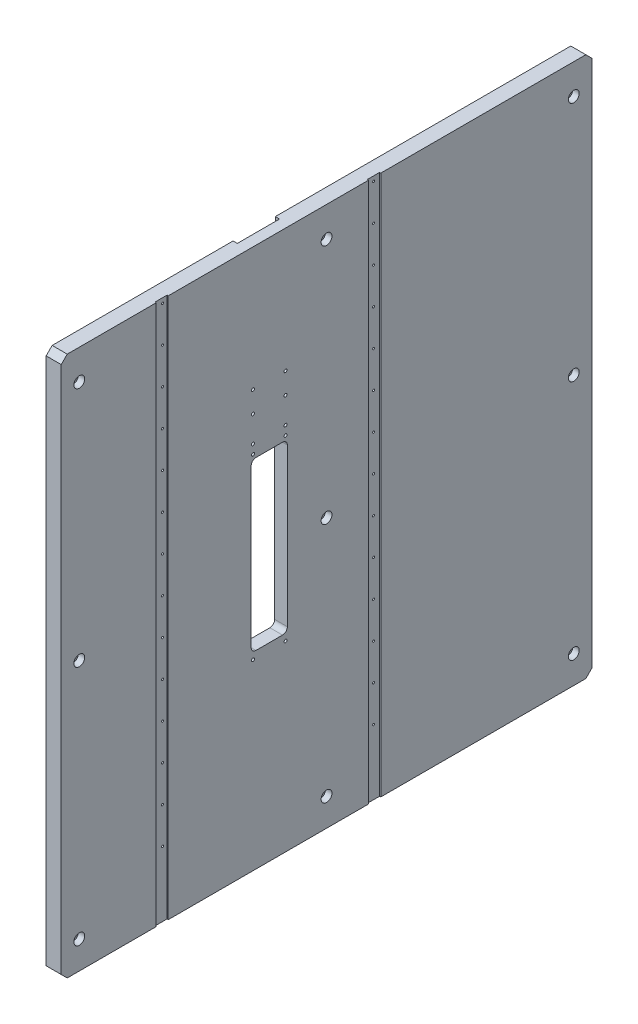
SolidWorks part; units mm, degrees
ref_plane "Plan1" through (0, 0, 0) normal (0, 0, 1) x (1, 0, 0)
ref_plane "Plan2" through (0, 0, 0) normal (0, 1, 0) x (1, 0, 0)
ref_plane "Plan3" through (0, 0, 0) normal (1, 0, 0) x (0, 0, -1)
sketch "Esquisse1" plane through (0, 0, 0) normal (1, 0, 0) x (0, 0, -1)
  line L0 (0, 1140.1905) -> (0, -182.5487) construction
  line L1 (0, 13.75) -> (0, -13.75) construction
  line L2 (13.75, 0) -> (-13.75, 0) construction
  line L3 (-440, 896) -> (440, 896)
  line L4 (-440, 896) -> (-440, 0)
  line L5 (-440, 0) -> (440, 0)
  line L6 (440, 896) -> (440, 0)
  line L9 (-117, 591) -> (-73, 591)
  line L10 (-65, 583) -> (-65, 322)
  line L11 (-73, 314) -> (-117, 314)
  line L13 (-95, 1011.7052) -> (-95, 113.1984) construction
  line L14 (-125, 583) -> (-125, 322)
  arc A0 (-73, 314) -> (-65, 322) centre (-73, 322) ccw
  arc A1 (-65, 583) -> (-73, 591) centre (-73, 583) ccw
  arc A2 (-117, 314) -> (-125, 322) centre (-117, 322) cw
  arc A3 (-125, 583) -> (-117, 591) centre (-117, 583) cw
  dimension "D8" = 8
  dimension "D1" = 896
  dimension "D2" = 440
  dimension "D3" = 305
  dimension "D4" = 30
  dimension "D5" = 440
  dimension "D6" = 277
  dimension "D7" = 95
extrude "Boss.-Extru.1" add sketch "Esquisse1" against normal blind 25
sketch "Esquisse17" plane through (0, 0, 0) normal (-1, 0, 0) x (0, 0, 1)
  line L0 (-440, 896) -> (440, 896) construction
  line L1 (-90, 896) -> (-70, 896)
  line L2 (-90, 896) -> (-90, 0)
  line L3 (-90, 0) -> (-70, 0)
  line L4 (-70, 896) -> (-70, 0)
  line L5 (262.5, 896) -> (282.5, 896)
  line L6 (262.5, 896) -> (262.5, 0)
  line L7 (262.5, 0) -> (282.5, 0)
  line L8 (282.5, 896) -> (282.5, 0)
  line L9 (440, 0) -> (-440, 0) construction
  line L10 (-80, -146.0818) -> (-80, 876.5476) construction
  line L12 (0, -13.75) -> (0, 13.75) construction
  line L14 (270, -75.7623) -> (270, 876.5476) construction
  dimension "D1" = 7.5
  dimension "D2" = 350
  dimension "D3" = 20
  dimension "D4" = 20
  dimension "D5" = 270
extrude "Enlèv. mat.-Extru.6" cut sketch "Esquisse17" along normal blind 2
hole_wizard "Trou taraudé M44" positions "Esquisse18" profile "Esquisse19" tap size "M4" standard "ISO"
sketch "Esquisse18" plane through (-2, 0, 0) normal (1, 0, 0) x (0, 0, -1)
  line L0 (-270, -75.7623) -> (-270, 876.5476) construction
  line L1 (80, -146.0818) -> (80, 876.5476) construction
  line L2 (70, 896) -> (90, 896) construction
  point P0 (80, 888)
  point P2 (-270, 888)
  dimension "D1" = 8
sketch "Esquisse19" plane through (-2, 888, -80) normal (0, 1, 0) x (0, 0, -1)
  line L0 (0, 0) -> (0, 23)
  line L1 (0, 23) -> (1.65, 23)
  line L2 (1.65, 23) -> (1.65, 0)
  line L5 (1.65, 0) -> (0, 0)
  line L11 (0, -6.35) -> (0, 107.95) construction
  dimension "Diamètre du trou pour taraudage jusqu'au prochain" = 3.3
  dimension "Profondeur du trou pour taraudage jusqu'au prochain" = 23
pattern_linear "Répétition linéaire5" count 14 spacing 60 along (0, -1, 0) of "Trou taraudé M44"
hole_wizard "Chambrage pour vis à tête hexagonale M101" positions "Esquisse22" profile "Esquisse23" counterbore size "M10" standard "ISO"
sketch "Esquisse22" plane through (0, 0, 0) normal (1, 0, 0) x (0, 0, -1)
  line L0 (0, 811.1286) -> (0, 326.5264) construction
  line L2 (0, 13.75) -> (0, -13.75) construction
  line L3 (440, 896) -> (90, 896) construction
  line L4 (-440, 0) -> (440, 0) construction
  line L5 (410, 846) -> (410, 446)
  line L6 (410, 446) -> (410, 46)
  point P0 (-410, 846)
  point P2 (410, 846)
  point P4 (410, 46)
  point P6 (-410, 46)
  point P31 (410, 446)
  point P33 (-410, 446)
  point P34 (0, 846)
  point P36 (0, 446)
  point P38 (0, 46)
  dimension "D1" = 820
  dimension "D2" = 50
  dimension "D3" = 800
  dimension "D4" = 46
sketch "Esquisse23" plane through (0, 846, 410) normal (0, 1, 0) x (0, 0, -1)
  line L0 (0, 0) -> (0, 25)
  line L1 (0, 25) -> (5.5, 25)
  line L3 (5.5, 25) -> (5.5, 10.6)
  line L4 (5.5, 10.6) -> (9, 10.6)
  line L5 (9, 10.6) -> (9, 0)
  line L7 (9, 0) -> (0, 0)
  line L11 (0, -6.35) -> (0, 107.95) construction
  dimension "Diamètre du perçage jusqu'au prochain" = 11
  dimension "Profondeur du perçage jusqu'au prochain" = 25
  dimension "Diamètre du chambrage" = 18
  dimension "Profondeur du chambrage" = 10.6
sketch "Esquisse24" plane through (-25, 0, 0) normal (-1, 0, 0) x (0, 0, 1)
  line L0 (95, 949.9984) -> (95, 121.356) construction
  line L1 (73, 314) -> (117, 314) construction
  line L2 (-440, 896) -> (440, 896) construction
  line L3 (60, 896) -> (130, 896)
  line L4 (60, 896) -> (60, 287)
  line L5 (70, 277) -> (120, 277)
  line L6 (130, 896) -> (130, 287)
  line L7 (95, 1011.7052) -> (95, 113.1984) construction
  arc A1 (70, 277) -> (60, 287) centre (70, 287) cw
  arc A2 (130, 287) -> (120, 277) centre (120, 287) cw
  dimension "D1" = 10
  dimension "D2" = 35
  dimension "D3" = 37
extrude "Enlèv. mat.-Extru.7" cut sketch "Esquisse24" against normal blind 4
hole_wizard "Trou taraudé M61" positions "Esquisse25" profile "Esquisse26" tap size "M6" standard "ISO"
sketch "Esquisse25" plane through (-21, 0, 0) normal (-1, 0, 0) x (0, 0, 1)
  line L0 (95, 949.9984) -> (95, 121.356) construction
  line L1 (95, 949.9984) -> (95, 121.356) construction
  line L5 (73, 591) -> (117, 591) construction
  point P0 (68, 691)
  point P2 (68, 656)
  point P4 (68, 613)
  point P6 (68, 598)
  point P8 (68, 303)
  point P14 (122, 303)
  point P15 (122, 598)
  point P16 (122, 613)
  point P17 (122, 656)
  point P18 (122, 691)
  dimension "D1" = 35
  dimension "D2" = 43
  dimension "D3" = 15
  dimension "D4" = 295
  dimension "D5" = 54
  dimension "D6" = 7
sketch "Esquisse26" plane through (-21, 691, 68) normal (0, 1, 0) x (0, 0, 1)
  line L0 (0, 0) -> (0, 21)
  line L1 (0, 21) -> (2.5, 21)
  line L2 (2.5, 21) -> (2.5, 0)
  line L5 (2.5, 0) -> (0, 0)
  line L11 (0, -6.35) -> (0, 107.95) construction
  dimension "Diamètre du trou pour taraudage jusqu'au prochain" = 5
  dimension "Profondeur du trou pour taraudage jusqu'au prochain" = 21
hole_wizard "Trou taraudé M31" positions "Esquisse27" profile "Esquisse28" tap size "M3" standard "ISO"
sketch "Esquisse27" plane through (-25, 0, 0) normal (-1, 0, 0) x (0, 0, 1)
  line L0 (60, 896) -> (60, 287) construction
  line L1 (13.1664, 551) -> (372.4071, 551) construction
  line L4 (13.1664, 364) -> (379.6867, 364) construction
  line L6 (117, 314) -> (73, 314) construction
  line L8 (73, 591) -> (117, 591) construction
  point P0 (53, 568.5)
  point P2 (53, 533.5)
  point P20 (53, 381.5)
  point P23 (53, 346.5)
  dimension "D1" = 7
  dimension "D2" = 35
  dimension "D3" = 40
  dimension "D4" = 50
  dimension "D5" = 35
sketch "Esquisse28" plane through (-25, 568.5, 53) normal (0, 1, 0) x (0, 0, 1)
  line L0 (0, 0) -> (0, 8.2511)
  line L1 (0, 8.2511) -> (1.25, 7.5)
  line L2 (1.25, 7.5) -> (1.25, 0)
  line L5 (1.25, 0) -> (0, 0)
  line L10 (0, 8.2511) -> (-1.25, 7.5) construction
  line L11 (0, -6.35) -> (0, 107.95) construction
  dimension "Diamètre du trou pour taraudage" = 2.5
  dimension "Profondeur du trou pour taraudage" = 7.5
  dimension "Angle de pointe" = 118
pattern_linear "Répétition linéaire6" count 3 spacing 5 along (0, -1, 0) of "Trou taraudé M31"
sketch "Esquisse29" plane through (-21, 0, 0) normal (-1, 0, 0) x (0, 0, 1)
  line L1 (60, 896) -> (130, 896)
  line L2 (60, 896) -> (60, 721)
  line L3 (70, 711) -> (120, 711)
  line L4 (130, 896) -> (130, 721)
  line L6 (60, 896) -> (60, 287) construction
  line L7 (130, 287) -> (130, 896) construction
  line L8 (-440, 896) -> (60, 896) construction
  circle A0 centre (122, 691) radius 2.5 construction
  arc A1 (60, 721) -> (70, 711) centre (70, 721) ccw
  arc A2 (130, 721) -> (120, 711) centre (120, 721) cw
  dimension "D1" = 20
  dimension "D2" = 10
extrude "Enlèv. mat.-Extru.8" cut sketch "Esquisse29" against normal blind 3
chamfer "Chanfrein1" distance 10 angle 45 4 edges at (-12.5, 0, -440) (-12.5, 0, 440) (-12.5, 896, 440) (-12.5, 896, -440)
